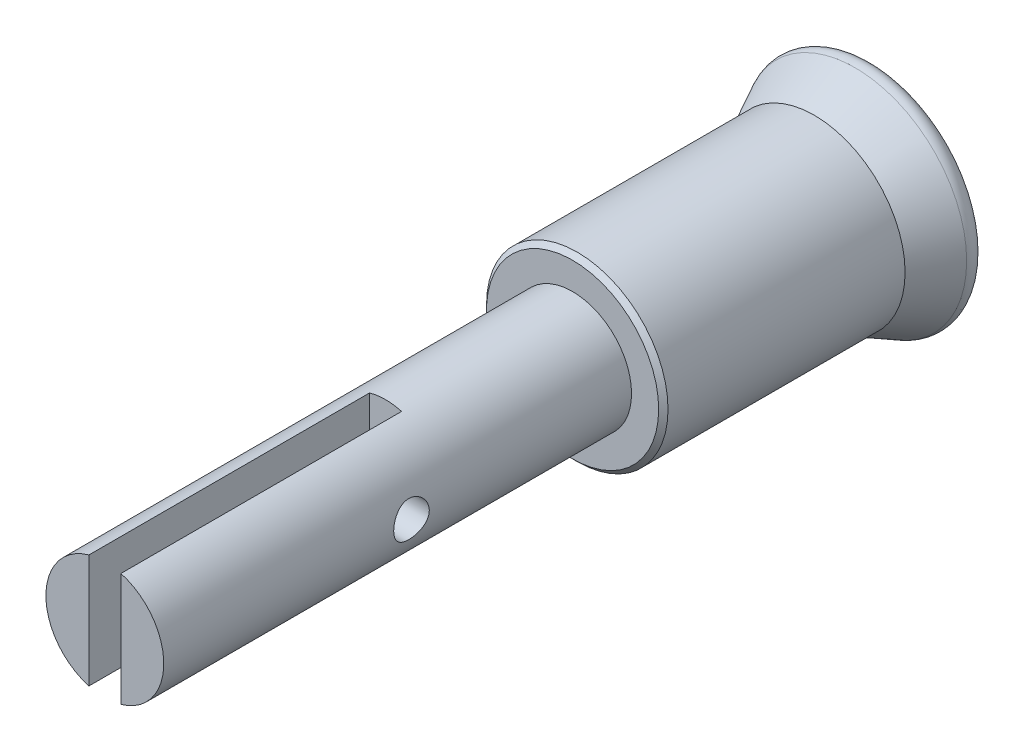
SolidWorks part; units mm, degrees
ref_plane "Front Plane" through (0, 0, 0) normal (0, 0, 1) x (1, 0, 0)
ref_plane "Top Plane" through (0, 0, 0) normal (0, 1, 0) x (1, 0, 0)
ref_plane "Right Plane" through (0, 0, 0) normal (1, 0, 0) x (0, 0, -1)
sketch "Sketch1" plane through (0, 0, 0) normal (0, 0, 1) x (1, 0, 0)
  circle A0 centre (0, 0) radius 7.9375
  dimension "D1" = 15.875
extrude "Boss-Extrude1" add sketch "Sketch1" along normal blind 7.62
fillet "Fillet2" radius 0.762 1 edges at (7.9375, 0, 7.62)
fillet "Fillet3" radius 0.762 1 edges at (7.9375, 0, 0)
sketch "Sketch2" plane through (0, 0, 7.62) normal (0, 0, 1) x (1, 0, 0)
  circle A0 centre (0, 0) radius 6.35
  dimension "D1" = 12.7
extrude "Boss-Extrude2" add sketch "Sketch2" along normal blind 12.7
sketch "Sketch3" plane through (0, 0, 20.32) normal (0, 0, 1) x (1, 0, 0)
  circle A0 centre (0, 0) radius 4.0005
  dimension "D1" = 8.001
extrude "Boss-Extrude3" add sketch "Sketch3" along normal blind 31.75
sketch "Sketch4" plane through (0, 0, 52.07) normal (0, 0, 1) x (1, 0, 0)
  line L1 (-1.0795, 4.391) -> (-1.0795, -4.391)
  line L2 (1.0922, 4.3879) -> (1.0922, -4.3879)
  arc A1 (-1.0795, -4.391) -> (1.0922, -4.3879) centre (0, 0) ccw
  arc A2 (1.0922, 4.3879) -> (-1.0795, 4.391) centre (0, 0) ccw
extrude "Cut-Extrude1" cut sketch "Sketch4" against normal blind 19.05
sketch "Sketch5" plane through (0, 0, 0) normal (1, 0, 0) x (0, 0, -1)
  circle A0 centre (-35.2556, 0) radius 1.2065
  dimension "D1" = 2.413
extrude "Cut-Extrude2" cut sketch "Sketch5" against normal mid plane 127
chamfer "Chamfer1" distance 0.508 angle 45 1 edges at (6.35, 0, 20.32)
sketch "Sketch6" plane through (0, 0, 0) normal (0, 0, -1) x (-1, 0, 0)
  circle A1 centre (0, 0) radius 8.89
  dimension "D1" = 17.78
extrude "Boss-Extrude4" add sketch "Sketch6" against normal blind 7.9375
chamfer "Chamfer2" distance 0.508 angle 45 2 edges at (-8.89, 0, 0) (-8.89, 0, 7.9375)
sketch "Sketch7" plane through (0, 0, 0) normal (0, 0, -1) x (-1, 0, 0)
  line L2 (0.3048, 8.7215) -> (0.3048, 9.0094)
  line L3 (-0.3048, 8.7215) -> (-0.3048, 9.0094)
  arc A0 (0.1752, 8.5945) -> (-0.1752, 8.5945) centre (0, 0) ccw
  arc A1 (0.1803, 9.1363) -> (-0.1803, 9.1363) centre (0, 0) ccw
  arc A2 (-0.3048, 8.7215) -> (-0.1752, 8.5945) centre (-0.1778, 8.7215) ccw
  arc A3 (0.1752, 8.5945) -> (0.3048, 8.7215) centre (0.1778, 8.7215) ccw
  arc A4 (0.3048, 9.0094) -> (0.1803, 9.1363) centre (0.1778, 9.0094) ccw
  arc A5 (-0.1803, 9.1363) -> (-0.3048, 9.0094) centre (-0.1778, 9.0094) ccw
  dimension "D1" = 0.127
extrude "Cut-Extrude3" cut sketch "Sketch7" against normal blind 7.9375
pattern_circular "CirPattern1" count 47 over 360 about axis through (0, 0, 0) along (0, 0, 1) of "Cut-Extrude3"
sketch "Sketch8" plane through (0, 0, 20.32) normal (0, 0, 1) x (1, 0, 0)
  circle A0 centre (0, 0) radius 6.1595
  circle A1 centre (0, 0) radius 10.8441
  dimension "D1" = 12.319
extrude "Cut-Extrude4" cut sketch "Sketch8" against normal blind 30.48
sketch "Sketch9" plane through (0, 0, 0) normal (0, 1, 0) x (1, 0, 0)
  line L0 (6.1595, 0) -> (6.8707, 0)
  line L1 (7.572, -1.1455) -> (6.1595, -3.9116)
  line L2 (6.1595, -20.0025) -> (6.1595, 0) construction
  line L3 (6.1595, 0) -> (6.1595, -3.9116)
  line L4 (0, 0) -> (0, 9.4487) construction
  arc A0 (6.8707, 0) -> (7.572, -1.1455) centre (6.8707, -0.7874) cw
  point P11 (8.1569, 0)
  dimension "D3" = 0.7874
  dimension "D2" = 15.3162
  dimension "D1" = 3.9116
revolve "Revolve1" add sketch "Sketch9" angle 360 about L4
